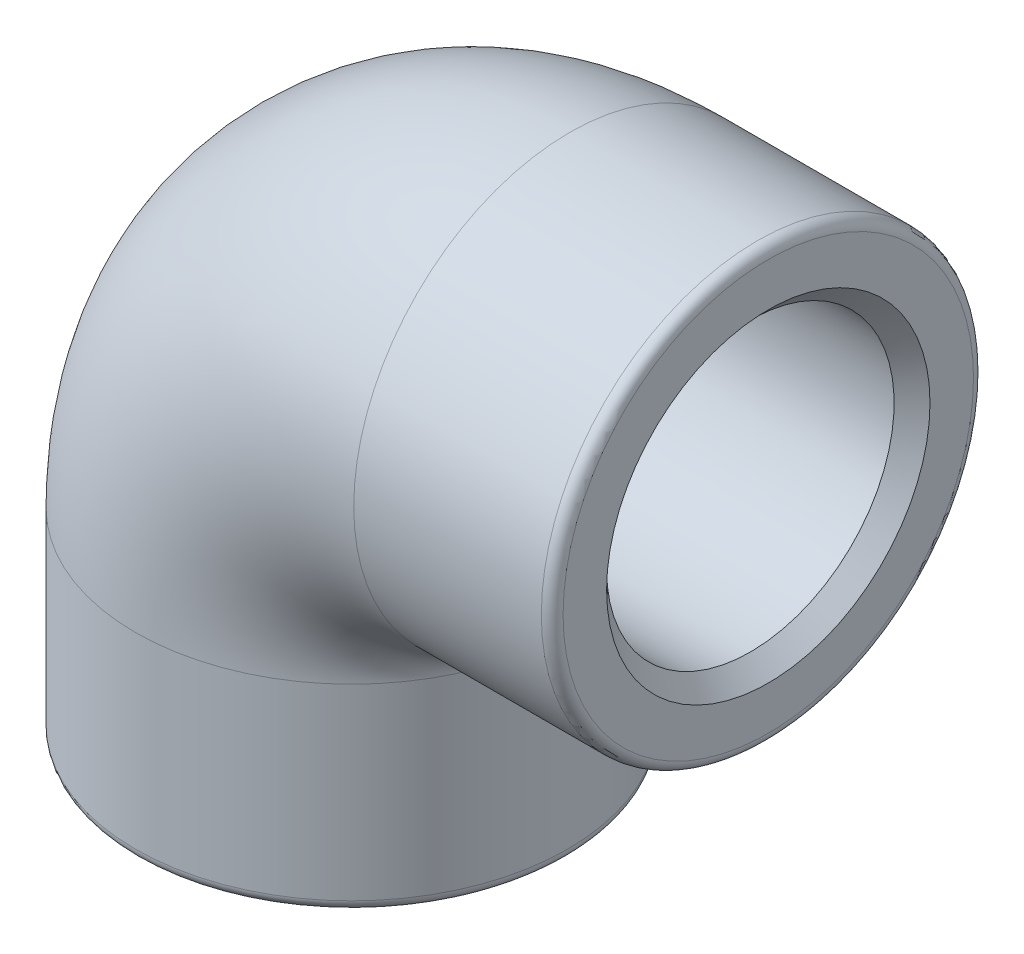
SolidWorks part; units mm, degrees
ref_plane "Front" through (0, 0, 0) normal (0, 0, 1) x (1, 0, 0)
ref_plane "Top" through (0, 0, 0) normal (0, 1, 0) x (1, 0, 0)
ref_plane "Right" through (0, 0, 0) normal (1, 0, 0) x (0, 0, -1)
imported_body "Imported3"
chamfer "Chamfer1" distance 1.162 angle 45
fillet "Fillet1" radius 0.7045 2 edges at (12.86, 14.14, 14) (-14.14, -12.86, 14)
